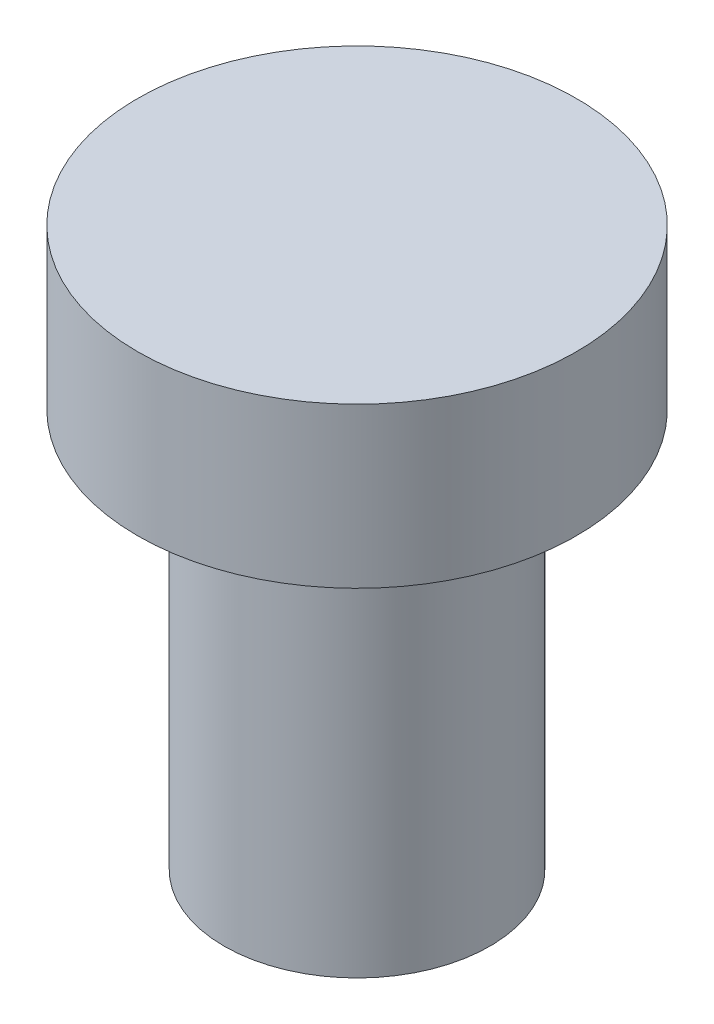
SolidWorks part; units mm, degrees
ref_plane "Front" through (0, 0, 0) normal (0, 0, 1) x (1, 0, 0)
ref_plane "Top" through (0, 0, 0) normal (0, 1, 0) x (1, 0, 0)
ref_plane "Right" through (0, 0, 0) normal (1, 0, 0) x (0, 0, -1)
sketch "Sketch1" plane through (0, 0, 0) normal (0, 1, 0) x (1, 0, 0)
  circle A0 centre (0, 0) radius 5
  dimension "D1" = 10
extrude "Extrude1" add sketch "Sketch1" along normal blind 15
sketch "Sketch2" plane through (0, 15, 0) normal (0, 1, 0) x (-1, 0, 0)
  circle A0 centre (0, 0) radius 8.2554
extrude "Extrude2" add sketch "Sketch2" along normal blind 6
sketch "Sketch3" plane through (0, 0, 0) normal (1, 0, 0) x (0, 0, -1)
  line L2 (0, 0) -> (0, 34.5814) construction
  line L9 (6.0056, 18) -> (6.0056, 18.9478)
  line L10 (6.0056, 18.9478) -> (9.5136, 19.1389)
  line L11 (9.5136, 19.1389) -> (9.1916, 16.3082)
  line L12 (9.1916, 16.3082) -> (7.5056, 16.5)
  arc A0 (7.5056, 16.5) -> (6.0056, 18) centre (6.0056, 16.5) ccw
  dimension "D1" = 1.5
